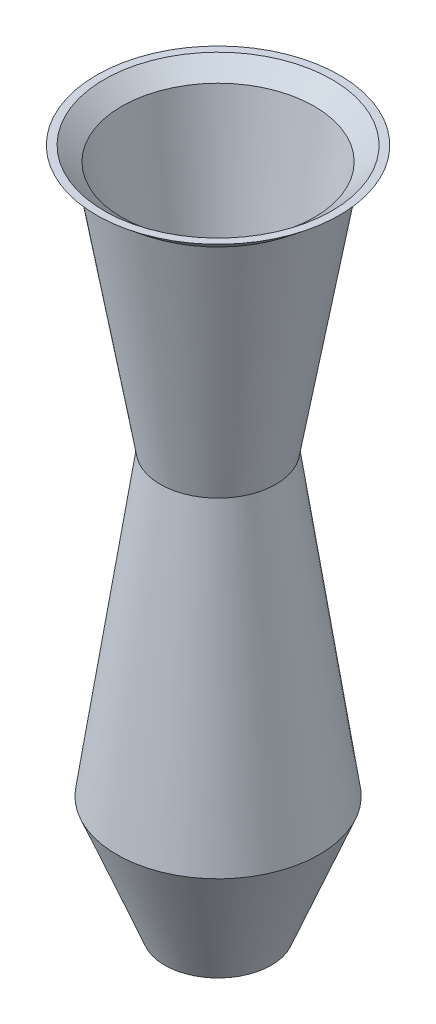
SolidWorks part; units mm, degrees
ref_plane "Front Plane" through (0, 0, 0) normal (0, 0, 1) x (1, 0, 0)
ref_plane "Top Plane" through (0, 0, 0) normal (0, 1, 0) x (1, 0, 0)
ref_plane "Right Plane" through (0, 0, 0) normal (1, 0, 0) x (0, 0, -1)
sketch "Sketch1" plane through (0, 0, 0) normal (0, 0, 1) x (1, 0, 0)
  line L0 (0, -1178.6716) -> (0, 57754.9076) construction
  line L1 (0, -806.3727) -> (254, -806.3727)
  line L2 (254, -806.3727) -> (508, -171.3727)
  line L3 (508, -171.3727) -> (279.4, 1403.4273)
  line L4 (279.4, 1403.4273) -> (508, 2724.2273)
  line L5 (508, 2724.2273) -> (600.71, 2800.4273)
  line L6 (600.71, 2800.4273) -> (0, 2800.4273)
  line L7 (0, -806.3727) -> (0, 2800.4273)
  dimension "D1" = 635
  dimension "D2" = 600.71
  dimension "D3" = 279.4
  dimension "D4" = 508
  dimension "D5" = 254
  dimension "D6" = 508
  dimension "D7" = 1320.8
  dimension "D8" = 76.2
  dimension "D9" = 1574.8
  dimension "D10" = 3606.8
revolve "Revolve1" add sketch "Sketch1" angle 360 about L0
fillet "Fillet2" radius 24.13 1 edges at (279.4, 1403.4273, 0)
shell "Shell1" thickness 25.4
